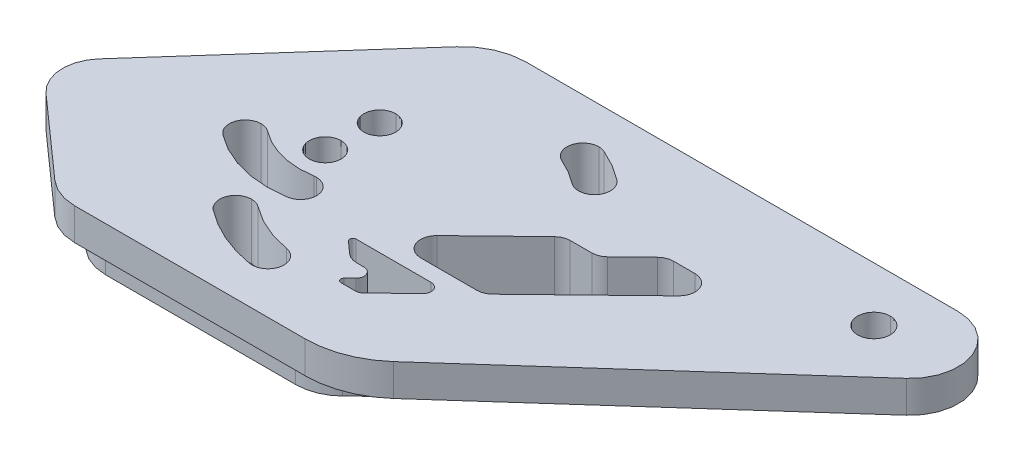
SolidWorks part; units mm, degrees
other "切除-拉伸2"
ref_plane "前视基准面" through (0, 0, 0) normal (0, 0, 1) x (1, 0, 0)
ref_plane "上视基准面" through (0, 0, 0) normal (0, 1, 0) x (1, 0, 0)
ref_plane "右视基准面" through (0, 0, 0) normal (1, 0, 0) x (0, 0, -1)
imported_body "镜头垫（倒角加螺丝孔）.STEP<1>"
mirror "镜向1"
delete or keep bodies "实体-删除/保留 1" type delete bodies bodies 101
